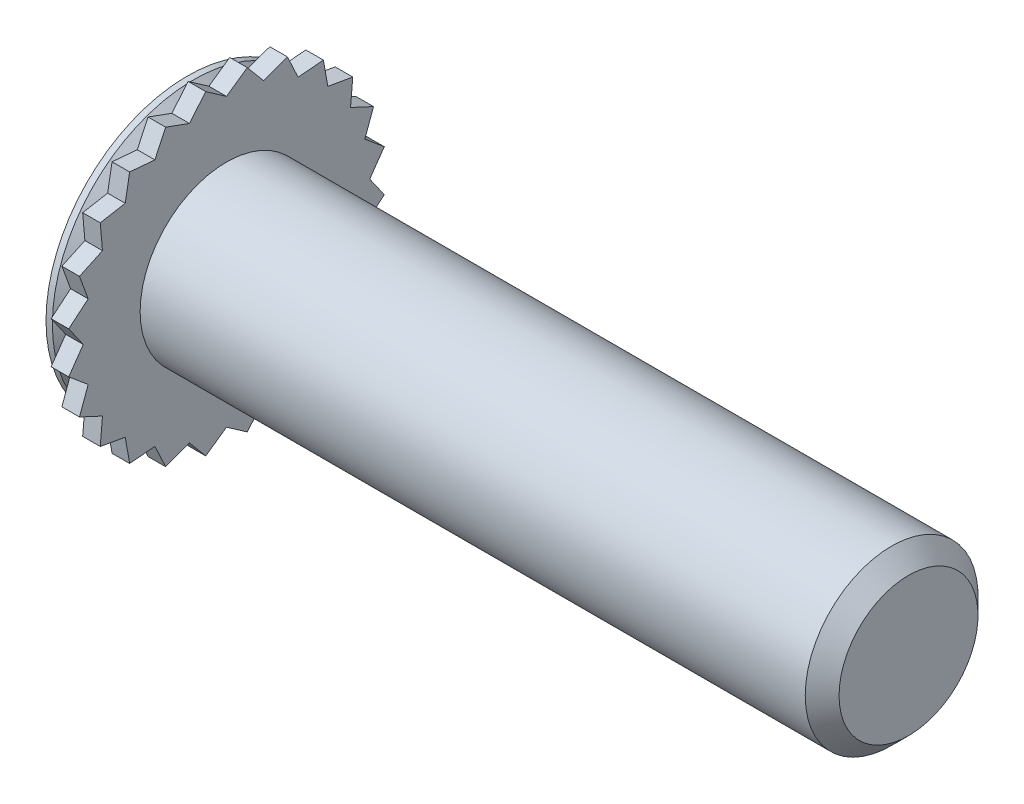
SolidWorks part; units mm, degrees
ref_plane "Plane1" through (0, 0, 0) normal (0, 0, 1) x (1, 0, 0)
ref_plane "Plane2" through (0, 0, 0) normal (0, 1, 0) x (1, 0, 0)
ref_plane "Plane3" through (0, 0, 0) normal (1, 0, 0) x (0, 0, -1)
sketch "BodySke" plane through (0, 0, 0) normal (0, 0, 1) x (1, 0, 0)
  line L0 (0, 2.2225) -> (0, 3.9497)
  line L1 (1.0922, 4.445) -> (0.6007, 4.445)
  line L2 (0.6007, 4.445) -> (0.6007, 3.636)
  line L3 (1.0922, 2.413) -> (19.6698, 2.413)
  line L4 (20.1422, 1.9406) -> (20.1422, 0)
  line L5 (20.1422, 0) -> (0.5461, 0)
  line L6 (0, 0) -> (50.554, 0) construction
  line L7 (1.0922, 4.445) -> (1.0922, 2.413)
  line L8 (20.1422, 1.9406) -> (19.6698, 2.413)
  line L9 (0.6007, 3.636) -> (0.4915, 3.636)
  line L10 (0.4915, 3.636) -> (0.1778, 3.9497)
  line L11 (1.8847, 19.05) -> (1.8847, -3.175) construction
  line L12 (0.1778, 3.9497) -> (0, 3.9497)
  line L13 (0, 2.2225) -> (0.5461, 1.6764)
  line L14 (0.5461, 1.6764) -> (0.5461, 0)
  dimension "D1" = 45
  dimension "Diameter" = 4.826
  dimension "Length" = 19.05
  dimension "Body_ch_ang" = 45
  dimension "Minor_dia" = 3.8811
  dimension "Advance" = 0.7925
  dimension "A_dim" = 1.0922
  dimension "Clinch_ht" = 0.4915
  dimension "E_dia" = 8.89
  dimension "C_dia" = 7.8994
  dimension "C_len" = 0.1778
  dimension "Skirt_ht" = 0.4915
  dimension "Face_clr_dep" = 0.5461
  dimension "Face_clr_dia" = 4.445
  dimension "Face_clr_ang" = 45
revolve "BaseBody" add sketch "BodySke" angle 360 about L6
sketch "ThdSchSke" plane through (0, 0, 0) normal (0, 0, 1) x (1, 0, 0)
  line L0 (2.667, -1.9406) -> (2.3362, -2.413)
  line L1 (2.667, -1.9406) -> (2.9978, -2.413)
  line L2 (2.9978, -2.413) -> (2.9978, -3.0162)
  line L3 (-3.175, 0) -> (5.1513, 0) construction
  line L5 (2.9978, -3.0162) -> (2.3362, -3.0162)
  line L6 (2.3362, -3.0162) -> (2.3362, -2.413)
  line L8 (1.0922, -2.413) -> (1.0922, 2.413) construction
  dimension "Thread_minor" = 3.8811
  dimension "Diameter" = 4.826
  dimension "Start" = 1.5748
  dimension "SideAngle" = 55
  dimension "VeeAngle" = 70
  dimension "Overcut" = 6.0325
revolve "ThreadSchematic" [suppressed] cut sketch "ThdSchSke" angle 360 about L3
pattern_linear "ThdSchPat" [suppressed]
sketch "CliRinCutSke" plane through (1.0922, 0, 0) normal (1, 0, 0) x (0, 0, -1)
  line L0 (0, 0) -> (0, 4.8256) construction
  line L1 (0.5802, 4.407) -> (0, 4.0005)
  line L2 (0, 4.0005) -> (-0.5802, 4.407)
  arc A0 (0.5802, 4.407) -> (-0.5802, 4.407) centre (0, 0) ccw
  circle A1 centre (0, 0) radius 4.445 construction
  circle A2 centre (0, 0) radius 4.0005 construction
  dimension "Clinch_minor" = 8.001
  dimension "Angle" = 15
extrude "ClinchCut" cut sketch "CliRinCutSke" against normal blind 0.4915
pattern_circular "ClinchCutPat" count 24 every 15 about axis through (0, 0, 0) along (1, 0, 0) of "ClinchCut"
equation "' \"Length@BodySke\" = 0.75"
equation "' \"A_dim@BodySke\" = 0.043"
equation "' \"E_dia@BodySke\" = 0.35"
equation "' \"C_dia@BodySke\" = 0.311"
equation "' \"Diameter@BodySke\" = 0.19"
equation "' \"Minor_dia@BodySke\" = 0.1528"
equation "' \"Advance@BodySke\" = 0.0312"
equation "\"Face_clr_dia@BodySke\" = \"E_dia@BodySke\" / 2"
equation "\"Face_clr_dep@BodySke\" = \"A_dim@BodySke\" / 2"
equation "\"Start@ThdSchSke\" = 0.062"
equation "\"Skirt_ht@BodySke\" = \"A_dim@BodySke\" * 0.45"
equation "\"Clinch_ht@BodySke\" = \"A_dim@BodySke\" * 0.45"
equation "\"Depth@ClinchCut\" = \"A_dim@BodySke\" * 0.45"
equation "\"Count@ClinchCutPat\" = 24"
equation "\"Angle@ClinchCutPat\" = 360 / \"Count@ClinchCutPat\""
equation "\"Angle@CliRinCutSke\" = 360 / \"Count@ClinchCutPat\""
equation "\"Clinch_minor@CliRinCutSke\" =  \"C_dia@BodySke\" "
equation "\"Clinch_minor@CliRinCutSke\" =  \"E_dia@BodySke\" * 0.9"
equation "\"Thread_length@ThreadCosmetic\" = \"Length@BodySke\" - \"Start@ThdSchSke\""
equation "\"Thread_minor@ThreadCosmetic\" = \"Minor_dia@BodySke\""
equation "\"Thread_minor@ThdSchSke\" = \"Minor_dia@BodySke\""
equation "\"Diameter@ThdSchSke\" = \"Diameter@BodySke\""
equation "\"Overcut@ThdSchSke\" = \"Diameter@BodySke\" * 1.25"
equation "\"Num_threads@ThdSchPat\" = int( \"Thread_length@ThreadCosmetic\" / \"Advance@BodySke\" + 0.999 )  + 1"
equation "\"Advance@ThdSchPat\" = \"Thread_length@ThreadCosmetic\" /  (\"Num_threads@ThdSchPat\" - 1) 'relax it"
equation "\"Num_threads@ThdSchPat\" = \"Num_threads@ThdSchPat\" - sgn( \"Num_threads@ThdSchPat\" - 1) '---chamfered tips only---"
